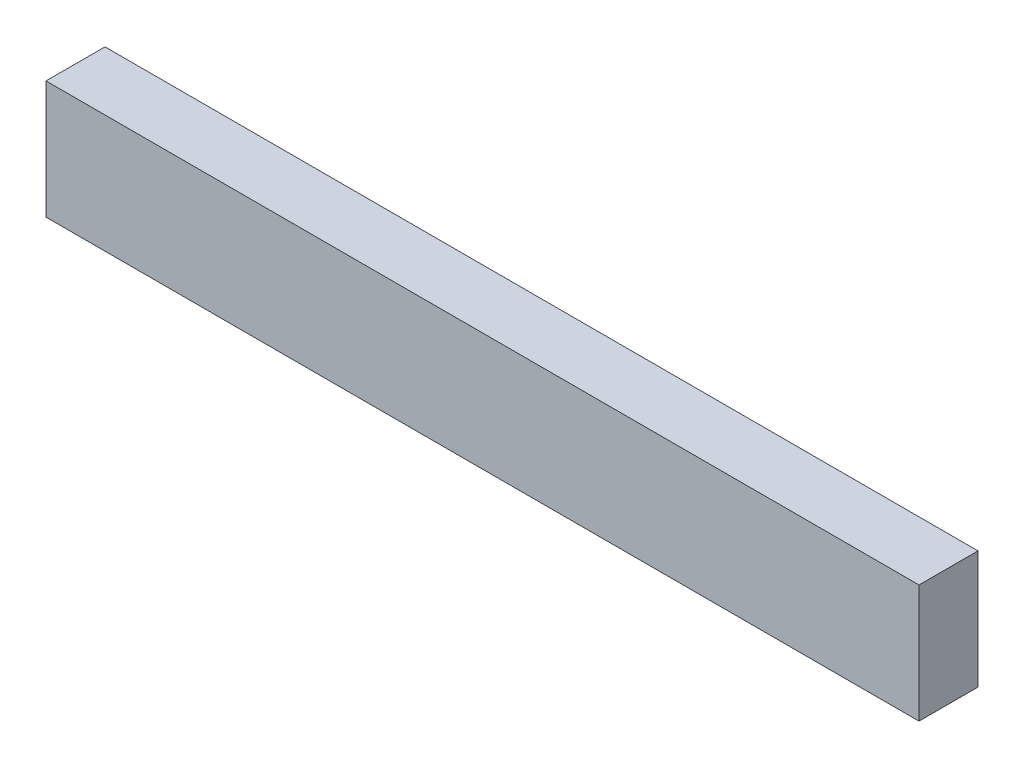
SolidWorks part; units mm, degrees
ref_plane "Front Plane" through (0, 0, 0) normal (0, 0, 1) x (1, 0, 0)
ref_plane "Top Plane" through (0, 0, 0) normal (0, 1, 0) x (1, 0, 0)
ref_plane "Right Plane" through (0, 0, 0) normal (1, 0, 0) x (0, 0, -1)
sketch "Sketch1" plane through (0, 0, 0) normal (0, 0, 1) x (1, 0, 0)
  line L1 (-185, 25) -> (185, 25)
  line L2 (-185, 25) -> (-185, -25)
  line L3 (-185, -25) -> (185, -25)
  line L4 (185, 25) -> (185, -25)
  line L5 (-185, 25) -> (185, -25) construction
  line L6 (-185, -25) -> (185, 25) construction
  point P0 (0, 0)
  dimension "D1" = 370
  dimension "D2" = 50
extrude "Boss-Extrude1" add sketch "Sketch1" along normal blind 25
